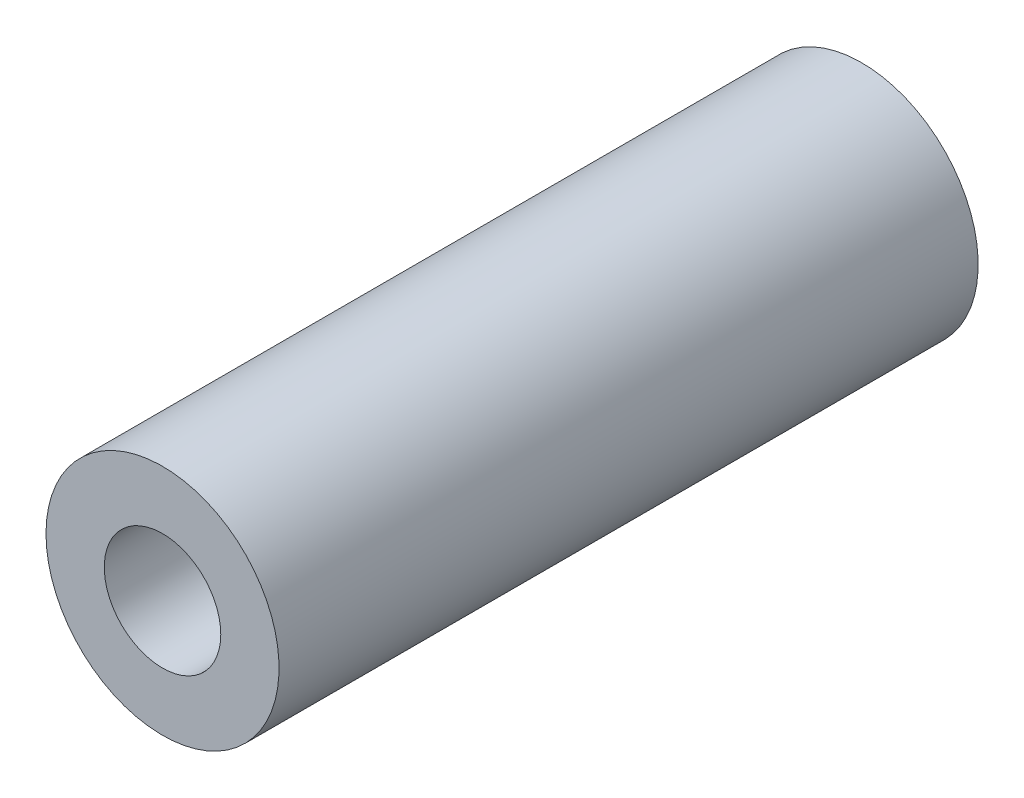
SolidWorks part; units mm, degrees
ref_plane "Front Plane" through (0, 0, 0) normal (0, 0, 1) x (1, 0, 0)
ref_plane "Top Plane" through (0, 0, 0) normal (0, 1, 0) x (1, 0, 0)
ref_plane "Right Plane" through (0, 0, 0) normal (1, 0, 0) x (0, 0, -1)
sketch "Sketch1" plane through (0, 0, 0) normal (0, 0, 1) x (1, 0, 0)
  circle A0 centre (0, 0) radius 3.175
  dimension "D1" = 6.35
extrude "Boss-Extrude1" add sketch "Sketch1" along normal blind 19.05
sketch "Sketch2" plane through (0, 0, 19.05) normal (0, 0, 1) x (1, 0, 0)
  circle A0 centre (0, 0) radius 1.5875
  dimension "D1" = 3.175
extrude "Cut-Extrude1" cut sketch "Sketch2" against normal blind 38.1
